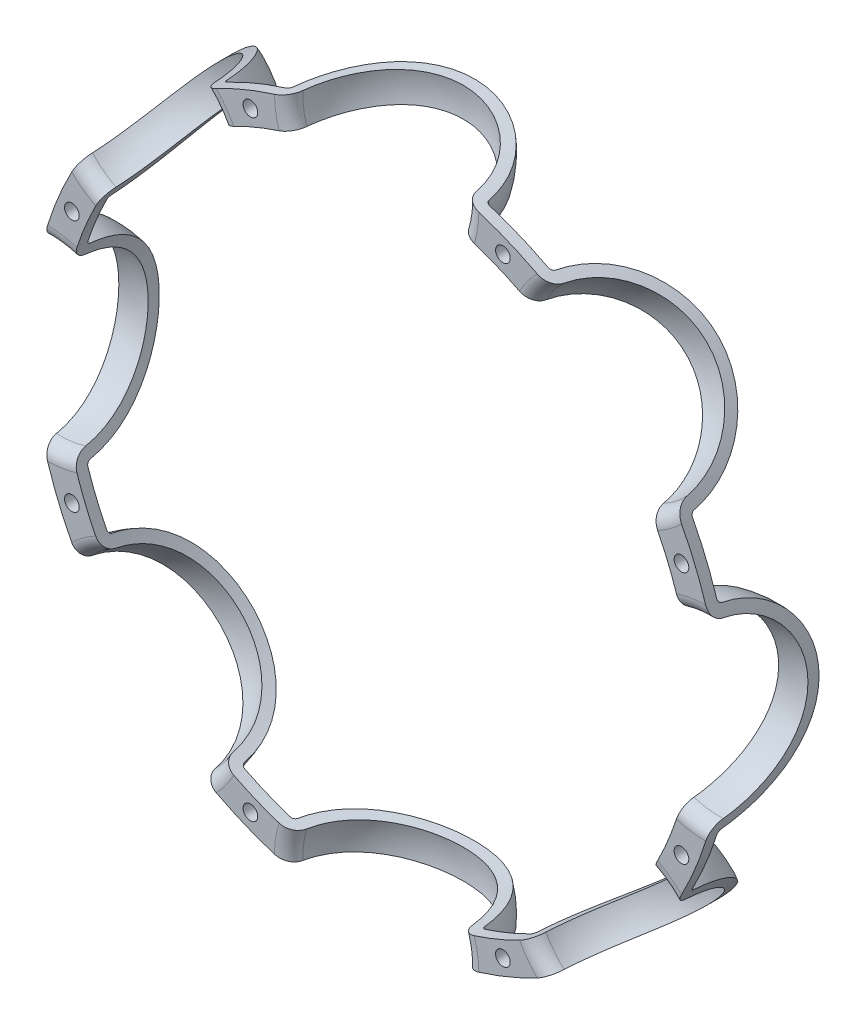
SolidWorks part; units mm, degrees
ref_plane "Front Plane" through (0, 0, 0) normal (0, 0, 1) x (1, 0, 0)
ref_plane "Top Plane" through (0, 0, 0) normal (0, 1, 0) x (1, 0, 0)
ref_plane "Right Plane" through (0, 0, 0) normal (1, 0, 0) x (0, 0, -1)
sketch "Sketch1" plane through (0, 0, 0) normal (0, 0, 1) x (1, 0, 0)
  circle A0 centre (0, 0) radius 43
  circle A1 centre (0, 0) radius 47
  dimension "D1" = 86
  dimension "D2" = 94
extrude "Boss-Extrude1" add sketch "Sketch1" along normal mid plane 16
sketch "Sketch2" plane through (0, 0, 8) normal (0, 0, 1) x (1, 0, 0)
  line L0 (0, 0) -> (0, 87.6626) construction
  line L1 (0, 57) -> (0, 33)
  arc A0 (0, 57) -> (0, 33) centre (0, 45) cw
  circle A1 centre (0, 0) radius 45 construction
  dimension "D1" = 90
  dimension "D2" = 12
revolve "Cut-Revolve1" cut sketch "Sketch2" angle 360 about L0
fillet "Fillet1" radius 2.1 2 edges at (-11.8958, 43.422, 8) (11.8958, 43.422, 8)
pattern_circular "CirPattern1" count 8 over 360 about axis through (0, 0, 0) along (0, 0, 1) of "Fillet1", "Cut-Revolve1"
shell "Shell1" thickness 1.5
sketch "Sketch3" plane through (0, 0, 8) normal (0, 0, 1) x (1, 0, 0)
  line L0 (0, 0) -> (0, 61.0825) construction
  line L1 (0, 49.3103) -> (0, 33.06) construction
  line L2 (0, 0) -> (17.2208, 41.5746) construction
  circle A0 centre (0, 0) radius 45 construction
  circle A1 centre (17.2208, 41.5746) radius 1
  dimension "D2" = 2
  dimension "D1" = 22.5
extrude "Cut-Extrude1" cut sketch "Sketch3" against normal through all
pattern_circular "CirPattern2" count 8 over 360 about axis through (0, 0, 0) along (0, 0, 1) of "Cut-Extrude1"
